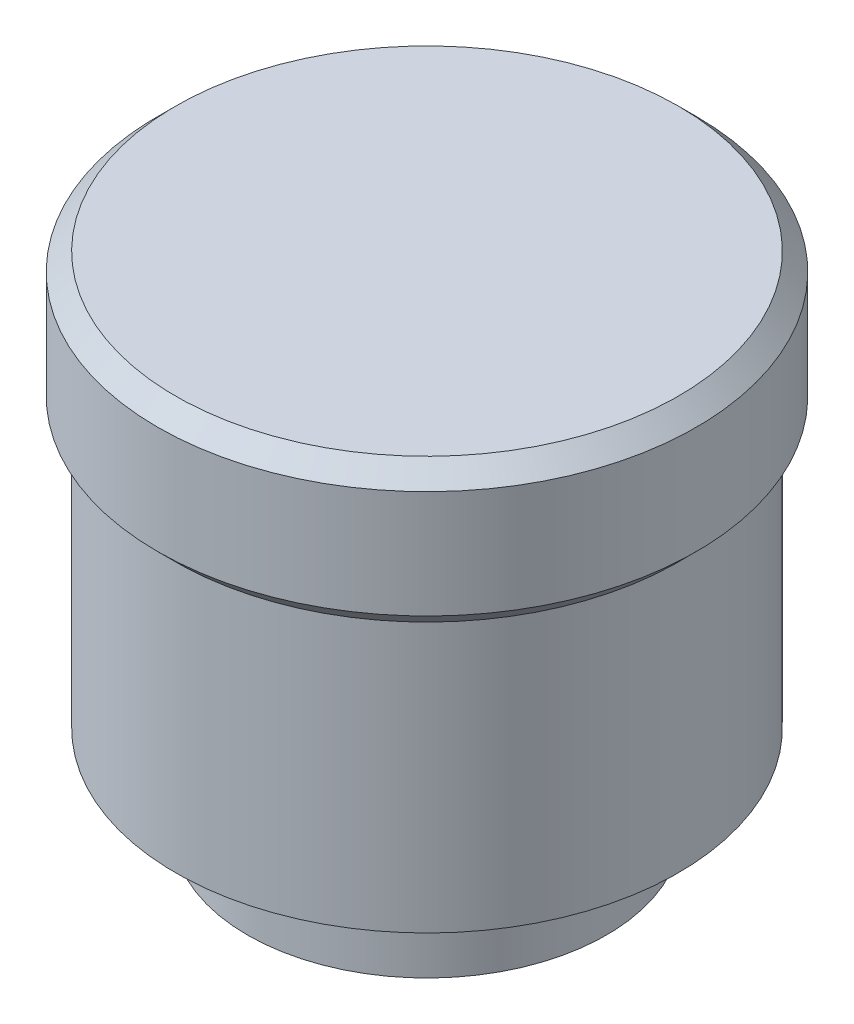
SolidWorks part; units mm, degrees
ref_plane "Front Plane" through (0, 0, 0) normal (0, 0, 1) x (1, 0, 0)
ref_plane "Top Plane" through (0, 0, 0) normal (0, 1, 0) x (1, 0, 0)
ref_plane "Right Plane" through (0, 0, 0) normal (1, 0, 0) x (0, 0, -1)
sketch "Sketch1" plane through (0, 0, 0) normal (1, 0, 0) x (0, 0, -1)
  line L0 (0, 0) -> (0, 28)
  line L1 (0, 28) -> (14, 28)
  line L2 (15, 27) -> (15, 21)
  line L3 (15, 21) -> (14, 20)
  line L4 (14, 20) -> (14, 5)
  line L5 (14, 5) -> (10, 5)
  line L6 (10, 5) -> (10, 0)
  line L7 (10, 0) -> (0, 0)
  line L8 (14, 28) -> (15, 27)
  point P4 (15, 28)
  dimension "D1" = 1
  dimension "D2" = 28
  dimension "D5" = 15
  dimension "D6" = 10
  dimension "D7" = 14
  dimension "D8" = 135
  dimension "D4" = 23
  dimension "D9" = 8
revolve "Revolve1" add sketch "Sketch1" angle 360 about L0
sketch "Sketch2" plane through (0, 0, 0) normal (0, -1, 0) x (1, 0, 0)
  line L0 (0, 10) -> (0, -10) construction
  circle A0 centre (0, 0) radius 10 construction
  point P5 (0, -4)
  dimension "D1" = 4
hole_wizard "M4 Tapped Hole1" positions "3DSketch1" profile "Sketch4" tap size "M4" standard "ISO"
sketch3d "3DSketch1"
  point P0 (0, 0, -4)
sketch "Sketch4" plane through (0, 0, -4) normal (1, 0, 0) x (0, 0, -1)
  line L0 (0, 0) -> (0, 16.9914)
  line L1 (0, 16.9914) -> (1.65, 16)
  line L2 (1.65, 16) -> (1.65, 0)
  line L5 (1.65, 0) -> (0, 0)
  line L10 (0, 16.9914) -> (-1.65, 16) construction
  line L11 (0, -6.35) -> (0, 107.95) construction
  dimension "Tap Drill Dia." = 3.3
  dimension "Tap Drill Depth" = 16
  dimension "Drill Angle" = 118
